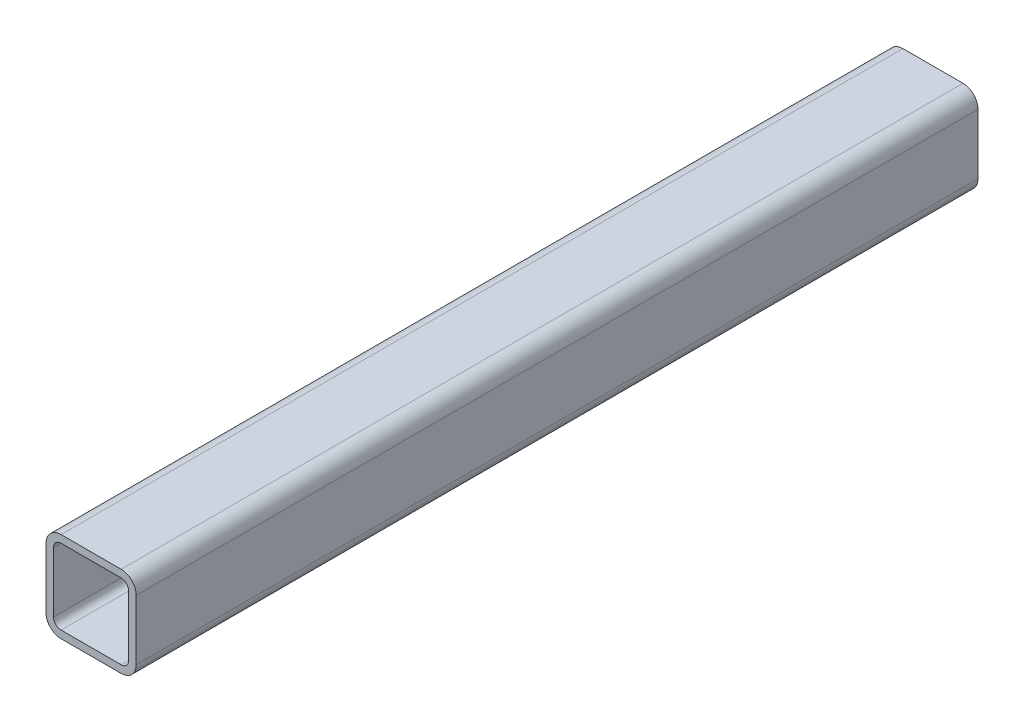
SolidWorks part; units mm, degrees
ref_plane "Front" through (0, 0, 0) normal (0, 0, 1) x (1, 0, 0)
ref_plane "Top" through (0, 0, 0) normal (0, 1, 0) x (1, 0, 0)
ref_plane "Right" through (0, 0, 0) normal (1, 0, 0) x (0, 0, -1)
sketch "Sketch1" plane through (0, 0, 0) normal (0, 0, 1) x (1, 0, 0)
  line L0 (-25.4, 38.1) -> (25.4, 38.1)
  line L1 (-38.1, 25.4) -> (-38.1, -25.4)
  line L2 (25.4, -38.1) -> (-25.4, -38.1)
  line L3 (38.1, -25.4) -> (38.1, 25.4)
  line L4 (0, -38.1) -> (0, 38.1) construction
  arc A0 (-38.1, 25.4) -> (-25.4, 38.1) centre (-25.4, 25.4) cw
  arc A1 (-25.4, -38.1) -> (-38.1, -25.4) centre (-25.4, -25.4) cw
  arc A2 (38.1, -25.4) -> (25.4, -38.1) centre (25.4, -25.4) cw
  arc A3 (38.1, 25.4) -> (25.4, 38.1) centre (25.4, 25.4) ccw
  dimension "D1" = 12.7
  dimension "D2" = 76.2
  dimension "D3" = 76.2
extrude "Base-Extrude-Thin" add sketch "Sketch1" along normal blind 711.2 thin
